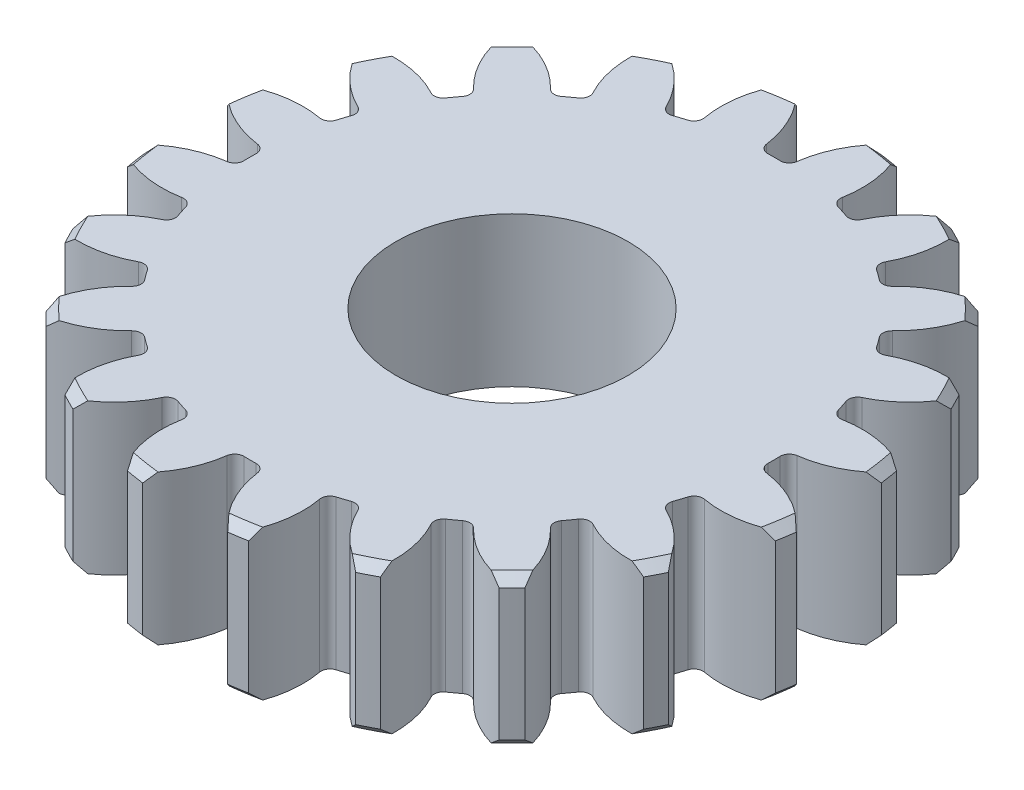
SolidWorks part; units mm, degrees
ref_plane "Front Plane" through (0, 0, 0) normal (0, 0, 1) x (1, 0, 0)
ref_plane "Top Plane" through (0, 0, 0) normal (0, 1, 0) x (1, 0, 0)
ref_plane "Right Plane" through (0, 0, 0) normal (1, 0, 0) x (0, 0, -1)
sketch "Sketch1" plane through (0, 0, 0) normal (0, 1, 0) x (1, 0, 0)
  circle A0 centre (0, 0) radius 20
  circle A1 centre (0, 0) radius 22
  circle A2 centre (0, 0) radius 17.5
extrude "Boss-Extrude1" add sketch "Sketch1" along normal blind 10 contours A1
sketch "Sketch2" plane through (0, 0, 0) normal (0, -1, 0) x (1, 0, 0)
  line L0 (0, 0) -> (0, 41.9432) construction
  line L1 (-0.9626, 17.4735) -> (0, 0) construction
  line L2 (0.9626, 17.4735) -> (0, 0) construction
  line L3 (-1.5692, 19.9383) -> (1.5692, 19.9383) construction
  line L4 (-5.0152, 27.5) -> (-4.0305, 25.3393) construction
  line L5 (-1.5692, 19.9383) -> (4.5196, 22.7132) construction
  line L6 (-1.5692, 19.9383) -> (1.8919, 20.2107) construction
  line L7 (0, 0) -> (6.5686, 41.4726) construction
  line L8 (1.5692, 19.9383) -> (4.6689, 19.4474) construction
  arc A0 (-2.8367, 21.8164) -> (-0.9626, 17.4735) centre (-7.8048, 17.0966) cw
  circle A1 centre (0, 0) radius 22 construction
  circle A2 centre (0, 0) radius 17.5 construction
  arc A3 (2.8367, 21.8164) -> (0.9626, 17.4735) centre (7.8048, 17.0966) ccw
  circle A4 centre (0, 0) radius 20 construction
  arc A5 (0.9626, 17.4735) -> (-0.9626, 17.4735) centre (0, 0) ccw
  arc A6 (2.8367, 21.8164) -> (-2.8367, 21.8164) centre (0, 0) ccw
  point P13 (-1.5692, 19.9383)
  point P14 (1.5692, 19.9383)
extrude "Cut-Extrude1" cut sketch "Sketch2" against normal up to surface (10 mm away)
fillet "Fillet1" radius 0.6 2 edges at (0.9626, 5, 17.4735) (-0.9626, 5, 17.4735)
chamfer "Chamfer1" distance 0.6 angle 45 2 edges at (0, 0, -22) (0, 10, -22)
pattern_circular "CirPattern1" count 20 over 360 about axis through (0, 0, 0) along (0, 1, 0) of "Cut-Extrude1", "Fillet1"
sketch "Sketch3" plane through (0, 0, 0) normal (0, -1, 0) x (1, 0, 0)
  circle A0 centre (0, 0) radius 7.75
  dimension "D1" = 15.5
extrude "Cut-Extrude2" cut sketch "Sketch3" against normal up to surface (10 mm away)
sketch "Sketch4" plane through (0, 10, 0) normal (0, 1, 0) x (1, 0, 0)
  point P0 (0, 0)
equation "\"module\"= 2mm"
equation "\"noTeeth\"= 20"
equation "\"pressureAngle\"= 20deg"
equation "\"width\"= 10mm"
equation "\"D1@Sketch1\"=\"module\"*\"noTeeth\""
equation "\"dedendum@Sketch1\" = \"module\" * 1.25"
equation "\"addendum@Sketch1\" = \"module\""
equation "\"D1@Sketch2\"=\"pressureAngle\""
equation "\"D2@Sketch2\"=180/\"noTeeth\""
equation "\"D1@Fillet1\"=0.3*\"module\""
equation "\"D1@Chamfer1\"=0.3*\"module\""
equation "\"D1@CirPattern1\"=\"noTeeth\""
